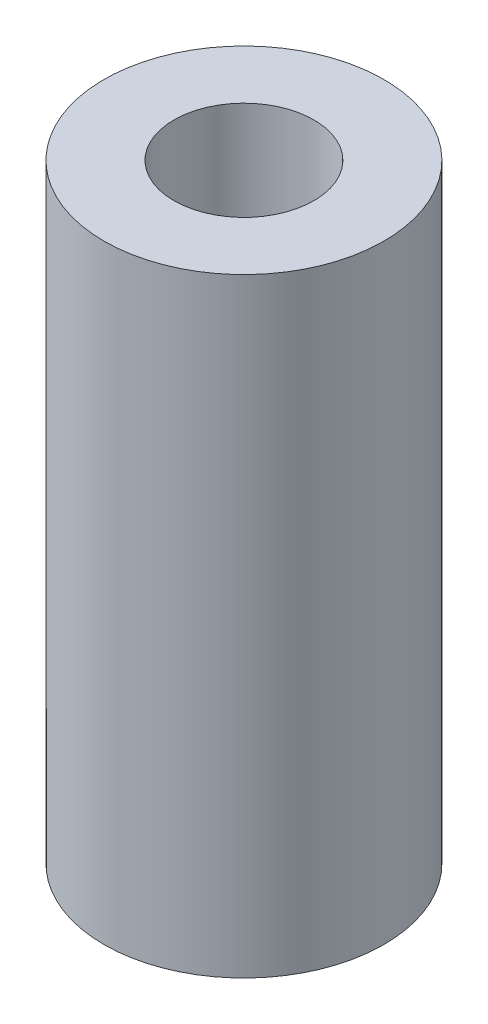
SolidWorks part; units mm, degrees
ref_plane "Front Plane" through (0, 0, 0) normal (0, 0, 1) x (1, 0, 0)
ref_plane "Top Plane" through (0, 0, 0) normal (0, 1, 0) x (1, 0, 0)
ref_plane "Right Plane" through (0, 0, 0) normal (1, 0, 0) x (0, 0, -1)
sketch "Sketch1" plane through (0, 0, 0) normal (0, 1, 0) x (1, 0, 0)
  circle A0 centre (0, 0) radius 9.525
  circle A1 centre (0, 0) radius 19.05
  dimension "D1" = 19.05
  dimension "D2" = 38.1
extrude "Boss-Extrude1" add sketch "Sketch1" along normal mid plane 82.9056
